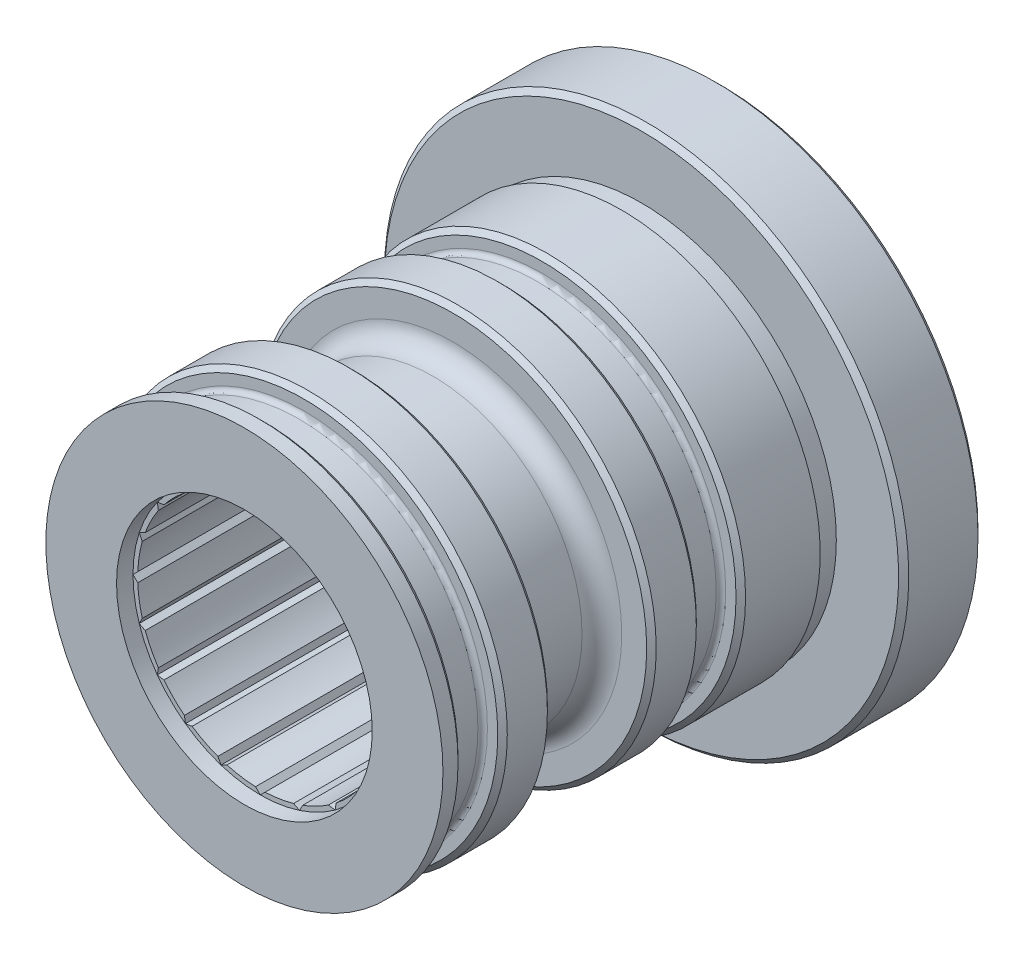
SolidWorks part; units mm, degrees
ref_plane "Front" through (0, 0, 0) normal (0, 0, 1) x (1, 0, 0)
ref_plane "Top" through (0, 0, 0) normal (0, 1, 0) x (1, 0, 0)
ref_plane "Right" through (0, 0, 0) normal (1, 0, 0) x (0, 0, -1)
sketch "Sketch1" plane through (0, 0, 0) normal (0, 0, 1) x (1, 0, 0)
  circle A0 centre (0, 0) radius 31.75
  dimension "D1" = 63.5
extrude "Extrude1" add sketch "Sketch1" along normal blind 76.2
sketch "Sketch3" plane through (0, 0, 76.2) normal (0, 0, 1) x (1, 0, 0)
  circle A0 centre (0, 0) radius 20.441
extrude "Cut-Extrude1" cut sketch "Sketch3" against normal blind 2.54 draft 2
sketch "Sketch4" plane through (0, 0, 73.66) normal (0, 0, 1) x (1, 0, 0)
  line L0 (0, 0) -> (20.3523, 0) construction
  line L1 (20.3523, 0) -> (19.5903, 0.762)
  line L2 (20.3523, 0) -> (19.5903, -0.762)
  arc A0 (19.5903, 0.762) -> (19.5903, -0.762) centre (0, 0) ccw
  circle A1 centre (0, 0) radius 20.3523
  circle A2 centre (0, 0) radius 20.3523 construction
  dimension "D2" = 45
  dimension "D3" = 45
  dimension "D4" = 1.524
  dimension "D1" = 0
extrude "Cut-Extrude2" cut sketch "Sketch4" against normal blind 27.94
pattern_circular "CirPattern1" count 20 over 360 about axis through (0, 0, 0) along (0, 0, 1) of "Cut-Extrude2"
sketch "Sketch5" plane through (0, 0, 45.72) normal (0, 0, 1) x (1, 0, 0)
  circle A0 centre (0, 0) radius 19.6051
  arc A1 (-18.8669, 5.329) -> (-19.5903, 0.762) centre (0, 0) ccw construction
extrude "Cut-Extrude3" cut sketch "Sketch5" against normal blind 1.524 draft 2
fillet "Fillet1" radius 0.8128 1 edges at (19.5519, 0, 44.196)
sketch "Sketch6" plane through (0, 0, 0) normal (1, 0, 0) x (0, 0, -1)
  line L0 (-76.2, 0) -> (0, 0) construction
  line L1 (-65.913, 31.75) -> (-59.4995, 31.75)
  line L2 (0, 31.75) -> (-76.2, 31.75) construction
  line L3 (-42.1005, 31.75) -> (-35.687, 31.75)
  line L4 (-73.025, 30.988) -> (-73.025, 29.337)
  line L5 (-72.263, 28.575) -> (-67.437, 28.575)
  line L6 (-66.675, 30.988) -> (-66.675, 29.337)
  line L7 (-50.8, 23.8252) -> (-50.8, 33.5649) construction
  line L8 (-27.813, 31.75) -> (-24.6383, 31.75)
  line L9 (-34.925, 30.988) -> (-34.925, 29.337)
  line L10 (-34.163, 28.575) -> (-29.337, 28.575)
  line L11 (-28.575, 30.988) -> (-28.575, 29.337)
  line L12 (-73.787, 31.75) -> (-76.2, 31.75)
  line L13 (-42.8625, 30.988) -> (-42.8625, 27.0002)
  line L14 (-46.0375, 23.8252) -> (-55.5625, 23.8252)
  line L15 (-58.7375, 30.988) -> (-58.7375, 27.0002)
  line L16 (-69.85, 28.575) -> (-69.85, 34.9819) construction
  line L17 (-31.75, 28.575) -> (-31.75, 34.9819) construction
  line L18 (-76.2, 31.75) -> (-76.2, -31.75) construction
  line L19 (-76.2, 31.75) -> (-76.2, 40.7077)
  line L20 (-76.2, 40.7077) -> (-24.6383, 40.7077)
  line L21 (-24.6383, 40.7077) -> (-24.6383, 31.75)
  line L22 (-66.675, 30.988) -> (-65.913, 31.75)
  line L23 (-73.025, 30.988) -> (-73.787, 31.75)
  line L24 (-42.8625, 30.988) -> (-42.1005, 31.75)
  line L25 (-59.4995, 31.75) -> (-58.7375, 30.988)
  line L26 (-35.687, 31.75) -> (-34.925, 30.988)
  line L27 (-28.575, 30.988) -> (-27.813, 31.75)
  arc A0 (-73.025, 29.337) -> (-72.263, 28.575) centre (-72.263, 29.337) ccw
  arc A1 (-67.437, 28.575) -> (-66.675, 29.337) centre (-67.437, 29.337) ccw
  arc A2 (-34.925, 29.337) -> (-34.163, 28.575) centre (-34.163, 29.337) ccw
  arc A3 (-29.337, 28.575) -> (-28.575, 29.337) centre (-29.337, 29.337) ccw
  arc A4 (-55.5625, 23.8252) -> (-58.7375, 27.0002) centre (-55.5625, 27.0002) cw
  arc A5 (-42.8625, 27.0002) -> (-46.0375, 23.8252) centre (-46.0375, 27.0002) cw
  point P2 (-73.025, 31.75)
  point P6 (-66.675, 31.75)
  point P9 (-34.925, 31.75)
  point P12 (-28.575, 31.75)
  point P13 (-42.8625, 31.75)
  point P16 (-58.7375, 31.75)
  point P27 (-73.025, 28.575)
  point P30 (-66.675, 28.575)
  point P33 (-34.925, 28.575)
  point P36 (-28.575, 28.575)
  point P39 (-58.7375, 23.8252)
  point P42 (-42.8625, 23.8252)
  dimension "D8" = 0.762
  dimension "D9" = 3.175
  dimension "D1" = 6.35
  dimension "D2" = 6.35
  dimension "D3" = 15.875
  dimension "D4" = 38.1
  dimension "D5" = 19.05
  dimension "D6" = 6.35
revolve "Cut-Revolve1" cut sketch "Sketch6" angle 360 about L0
sketch "Sketch7" plane through (0, 0, 0) normal (0, 0, -1) x (-1, 0, 0)
  circle A0 centre (0, 0) radius 41.9142
extrude "Extrude2" add sketch "Sketch7" against normal blind 12.7
chamfer "Chamfer1" distance 0.8128 angle 45 2 edges at (-41.9142, 0, 12.7) (-41.9142, 0, 0)
sketch "Sketch8" plane through (0, 0, 0) normal (0, 1, 0) x (1, 0, 0)
  line L0 (0, 0) -> (0, -20.1397) construction
  line L1 (-41.1014, -12.7) -> (41.1014, -12.7) construction
  line L2 (31.9624, -15.875) -> (31.1496, -15.875)
  line L3 (31.9624, -15.875) -> (31.9624, -12.7)
  line L4 (31.9624, -12.7) -> (31.1496, -12.7)
  line L5 (31.1496, -15.875) -> (31.1496, -12.7)
  dimension "D1" = 3.175
  dimension "D2" = 0.8128
revolve "Cut-Revolve2" cut sketch "Sketch8" angle 360 about L0
other "CounterBore1"
